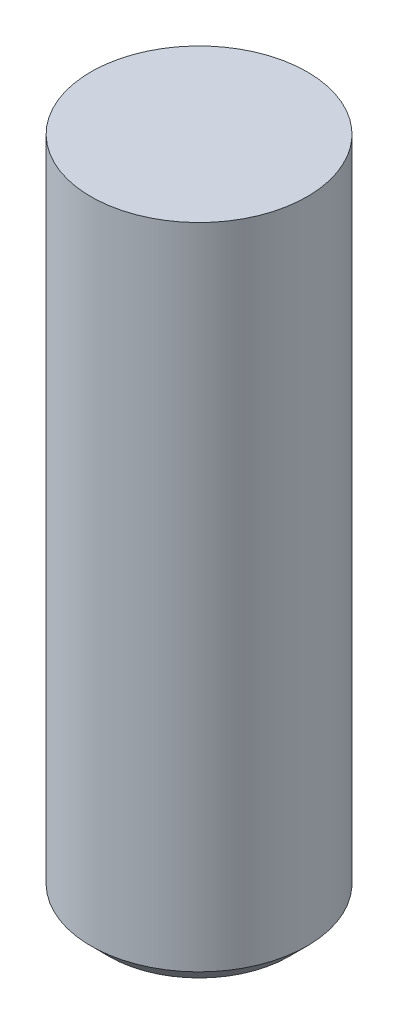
SolidWorks part; units mm, degrees
ref_plane "Plan de face" through (0, 0, 0) normal (0, 0, 1) x (1, 0, 0)
ref_plane "Plan de dessus" through (0, 0, 0) normal (0, 1, 0) x (1, 0, 0)
ref_plane "Plan de droite" through (0, 0, 0) normal (1, 0, 0) x (0, 0, -1)
sketch "Esquisse1" plane through (0, 0, 0) normal (0, 0, 1) x (1, 0, 0)
  line L0 (6, 0) -> (0, 0)
  line L1 (0, 0) -> (0, -37)
  line L2 (0, -37) -> (5, -37)
  line L3 (5, -37) -> (6, -36)
  line L4 (6, -36) -> (6, 0)
  line L5 (0, 0) -> (0, -37) construction
revolve "Révolution1" add sketch "Esquisse1" angle 360 about L5
